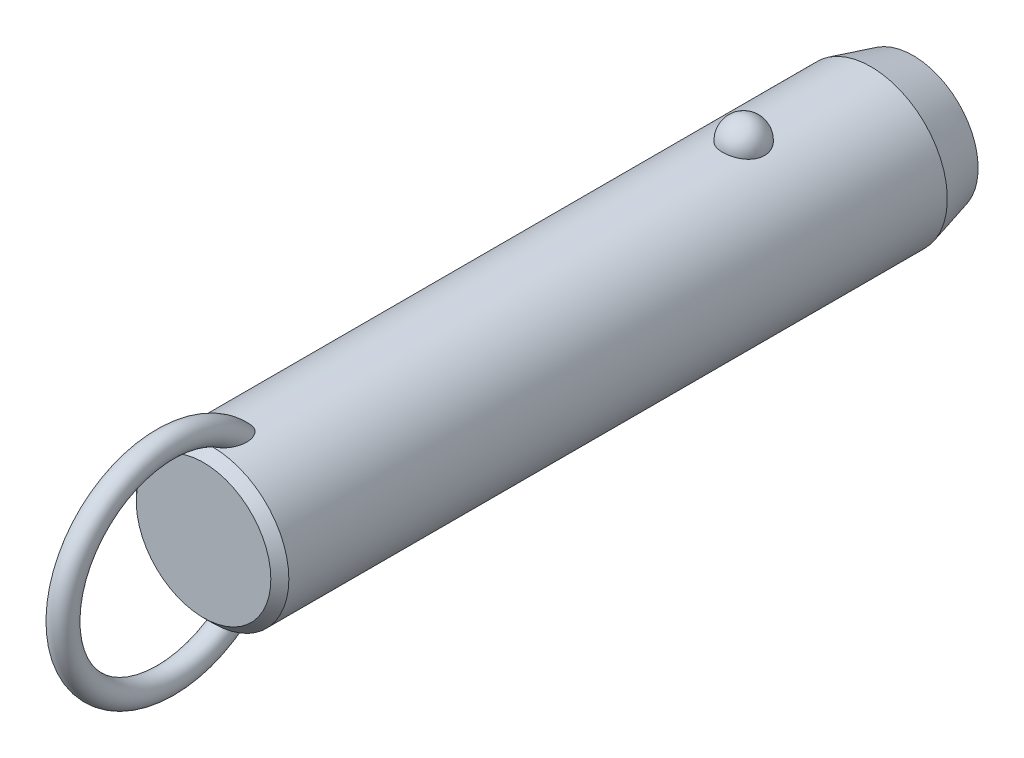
SolidWorks part; units mm, degrees
ref_plane "Front Plane" through (0, 0, 0) normal (0, 0, 1) x (1, 0, 0)
ref_plane "Top Plane" through (0, 0, 0) normal (0, 1, 0) x (1, 0, 0)
ref_plane "Right Plane" through (0, 0, 0) normal (1, 0, 0) x (0, 0, -1)
sketch "Sketch2" plane through (0, 0, 0) normal (0, 0, 1) x (1, 0, 0)
  circle A0 centre (0, 0) radius 12.7
  point P3 (0, 12.7)
  dimension "D1" = 25.4
extrude "Boss-Extrude1" add sketch "Sketch2" along normal blind 73.7
sketch "Sketch3" plane through (0, 0, 0) normal (0, 0, -1) x (-1, 0, 0)
  circle A0 centre (0, 0) radius 12.7
  dimension "D1" = 25.4
extrude "Boss-Extrude2" add sketch "Sketch3" along normal blind 31.7
chamfer "Chamfer1" distance 7 angle 15 1 edges at (-12.7, 0, -31.7)
sketch "Sketch12" plane through (0, 0, 0) normal (1, 0, 0) x (0, 0, -1)
  line L0 (-73.7, 12.7) -> (-73.7, -12.7) construction
  point P0 (-73.7, 0)
sketch "Sketch13" plane through (0, 0, 0) normal (1, 0, 0) x (0, 0, -1)
  circle A0 centre (-92.75, 0) radius 19.05
  point P2 (-73.7, 0)
  dimension "D1" = 38.1
sketch "Sketch14" plane through (0, 0, 0) normal (0, 1, 0) x (1, 0, 0)
  circle A0 centre (0, -75.7) radius 2
  point P2 (0, -73.7)
  dimension "D1" = 4
sweep "Sweep1" add profiles "Sketch14" path "Sketch13"
sketch "Sketch15" plane through (0, 0, 73.7) normal (0, 0, 1) x (1, 0, 0)
  circle A0 centre (0, 0) radius 12.7
  dimension "D1" = 25.4
extrude "Boss-Extrude3" add sketch "Sketch15" along normal blind 12.7
chamfer "Chamfer2" distance 1.5 angle 45 1 edges at (12.7, 0, 86.4)
sketch "Sketch18" plane through (0, 0, 0) normal (1, 0, 0) x (0, 0, -1)
  line L0 (24.7, 12.7) -> (-78.551, 12.7) construction
  line L1 (3.5, 16.2) -> (3.5, 9.2)
  line L2 (-78.551, -12.7) -> (24.7, -12.7) construction
  arc A0 (3.5, 16.2) -> (3.5, 9.2) centre (3.5, 12.7) ccw
  point P4 (0, 12.7)
  dimension "D1" = 28.9
revolve "Revolve1" add sketch "Sketch18" angle 360 about L1
